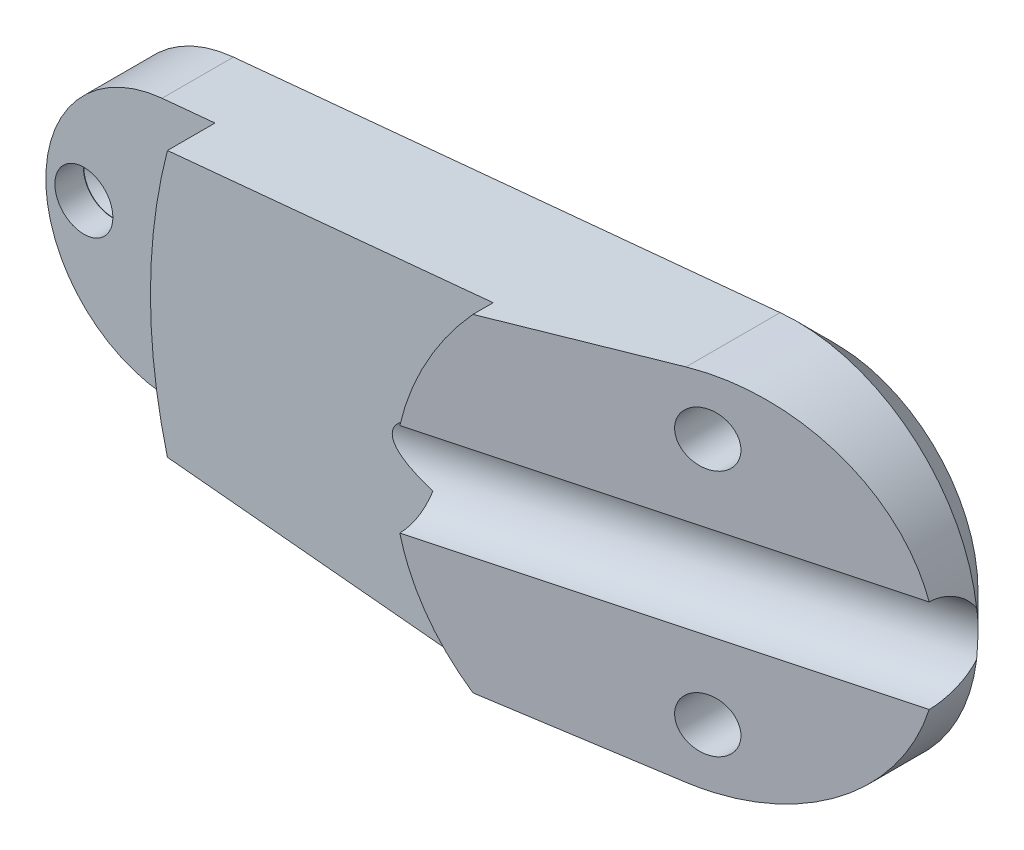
SolidWorks part; units mm, degrees
ref_plane "Face" through (0, 0, 0) normal (0, 0, 1) x (1, 0, 0)
ref_plane "Dessus" through (0, 0, 0) normal (0, 1, 0) x (1, 0, 0)
ref_plane "Droite" through (0, 0, 0) normal (1, 0, 0) x (0, 0, -1)
sketch "Esquisse1" plane through (0, 0, 0) normal (0, 0, 1) x (1, 0, 0)
  circle A0 centre (0, 0) radius 19
  dimension "D1" = 38
extrude "Extrusion1" add sketch "Esquisse1" along normal blind 18.5
sketch "Esquisse2" plane through (0, 0, 0) normal (0, 1, 0) x (1, 0, 0)
  line L0 (-19, -18.5) -> (19, -8.3179)
  line L2 (19, -18.5) -> (19, 0) construction
  line L3 (19, -18.5) -> (19, -8.3179)
  line L4 (-19, -18.5) -> (19, -18.5) construction
  line L5 (-19, -18.5) -> (19, -18.5)
  line L6 (19, 0) -> (-19, 0) construction
  dimension "D1" = 15
  dimension "D2" = 18.5
extrude "Enlèv. mat.-Extru.1" cut sketch "Esquisse2" against normal mid plane 50
sketch "Esquisse4" plane through (0, 0, 0) normal (0, 0, -1) x (-1, 0, 0)
  line L0 (1.8017, 18.9144) -> (59.2802, 13.4392)
  line L1 (1.8017, -18.9144) -> (59.2802, -13.4392)
  arc A0 (59.2802, -13.4392) -> (59.2802, 13.4392) centre (58, 0) ccw
  circle A1 centre (0, 0) radius 19 construction
  arc A2 (1.8017, -18.9144) -> (1.8017, 18.9144) centre (0, 0) ccw
  dimension "D2" = 27
  dimension "D1" = 58
extrude "Extrusion2" add sketch "Esquisse4" against normal blind 50
sketch "Esquisse3" plane through (0, 0, 0) normal (0, 1, 0) x (1, 0, 0)
  line L0 (-66.9494, -31.4515) -> (36.1784, -3.8185) construction
  line L2 (-1.8017, -13.8917) -> (19, -8.3179) construction
  line L3 (22.6966, -7.4309) -> (21.4284, -2.6979)
  line L4 (21.4284, -2.6979) -> (-46.1864, -20.8152)
  line L5 (-46.1864, -20.8152) -> (-44.9182, -25.5483)
  line L6 (-44.9182, -25.5483) -> (22.6966, -7.4309)
  dimension "D1" = 0.1
  dimension "D2" = 9.8
  dimension "D3" = 20
  dimension "D4" = 50
revolve "Enlèvement de matière-Révolution1" cut sketch "Esquisse3" angle 360 about L0
sketch "Esquisse6" plane through (0, 0, 0) normal (0, 1, 0) x (1, 0, 0)
  line L0 (-1.8017, -13.8917) -> (18.3576, -8.4901) construction
  line L1 (-71.5, -32.5673) -> (-1.8017, -13.8917)
  line L2 (-1.8017, -50) -> (-1.8017, -13.8917) construction
  line L3 (-1.8017, -50) -> (-1.8017, -13.8917)
  line L4 (-1.8017, -50) -> (-59.2802, -50) construction
  line L5 (-1.8017, -50) -> (-71.5, -50)
  line L6 (-71.5, 0) -> (-71.5, -50) construction
  line L7 (-71.5, -32.5673) -> (-71.5, -50)
extrude "Enlèv. mat.-Extru.3" cut sketch "Esquisse6" against normal mid plane 50
hole_wizard "Dégagement M51" positions "Esquisse8" profile "Esquisse7" hole size "M5" standard "ISO"
sketch "Esquisse8" plane through (0, 0, 0) normal (0, 0, -1) x (-1, 0, 0)
  point P1 (0, -13)
  point P2 (0, 13)
  dimension "D1" = 13
  dimension "D2" = 13
sketch "Esquisse7" plane through (0, -13, 0) normal (1, 0, 0) x (0, 1, 0)
  line L0 (0, 0) -> (0, 32.5673)
  line L1 (0, 32.5673) -> (2.75, 32.5673)
  line L2 (2.75, 32.5673) -> (2.75, 0)
  line L5 (2.75, 0) -> (0, 0)
  line L11 (0, -6.35) -> (0, 107.95) construction
  dimension "Diamètre du perçage jusqu'au prochain" = 5.5
  dimension "Profondeur du perçage jusqu'au prochain" = 32.5673
chamfer "Chanfrein1" distance 4 angle 45 4 edges at (-30.5409, -16.1768, 0) (-71.5, 0, 0) (19, 0, 0) (-30.5409, 16.1768, 0)
sketch "Esquisse11" plane through (0, 0, 0) normal (0, 1, 0) x (1, 0, 0)
  line L0 (-26, -20.3756) -> (-26, -16.5)
  line L1 (-26, -16.5) -> (-55.5, -16.5)
  line L2 (-55.5, -16.5) -> (-55.5, -11.5)
  line L3 (-55.5, -11.5) -> (-71.5, -11.5)
  line L4 (-71.5, -4) -> (-71.5, -32.5673) construction
  line L5 (-1.8017, -13.8917) -> (-59.2802, -29.293) construction
  line L6 (-26, -20.3756) -> (-71.5, -32.5673)
  line L7 (-71.5, -11.5) -> (-71.5, -32.5673)
  line L8 (0, 0) -> (0, -37.1028) construction
  line L9 (-58.9009, 0) -> (-2.0104, 0) construction
  dimension "D1" = 26
  dimension "D2" = 16.5
  dimension "D3" = 11.5
  dimension "D4" = 16
revolve "Enlèvement de matière-Révolution2" cut sketch "Esquisse11" angle 360 about L8
sketch "Esquisse12" plane through (0, 0, 11.5) normal (0, 0, 1) x (1, 0, 0)
  circle A0 centre (-67.5, 0) radius 3.05
  dimension "D1" = 6.1
  dimension "D2" = 67.5
extrude "Enlèv. mat.-Extru.6" cut sketch "Esquisse12" against normal blind 3
hole_wizard "Perçage1" positions "Esquisse14" profile "Esquisse13" legacy
sketch "Esquisse14" plane through (0, 0, 8.5) normal (0, 0, 1) x (1, 0, 0)
  circle A0 centre (-67.5, 0) radius 3.05 construction
  point P0 (-67.5, 0)
sketch "Esquisse13" plane through (-67.5, 0, 8.5) normal (1, 0, 0) x (0, -1, 0)
  line L0 (0, 0) -> (0, 1.7361)
  line L1 (0, 1.7361) -> (3, 0.004)
  line L2 (3, 0.004) -> (3, 0)
  line L4 (3, 0) -> (0, 0)
  line L6 (0, 1.7361) -> (-3, 0.004) construction
  line L7 (0, -4.2442) -> (0, 117.3081) construction
  dimension "Diamètre" = 6
  dimension "Profondeur" = 0.004
  dimension "Angle" = 120
